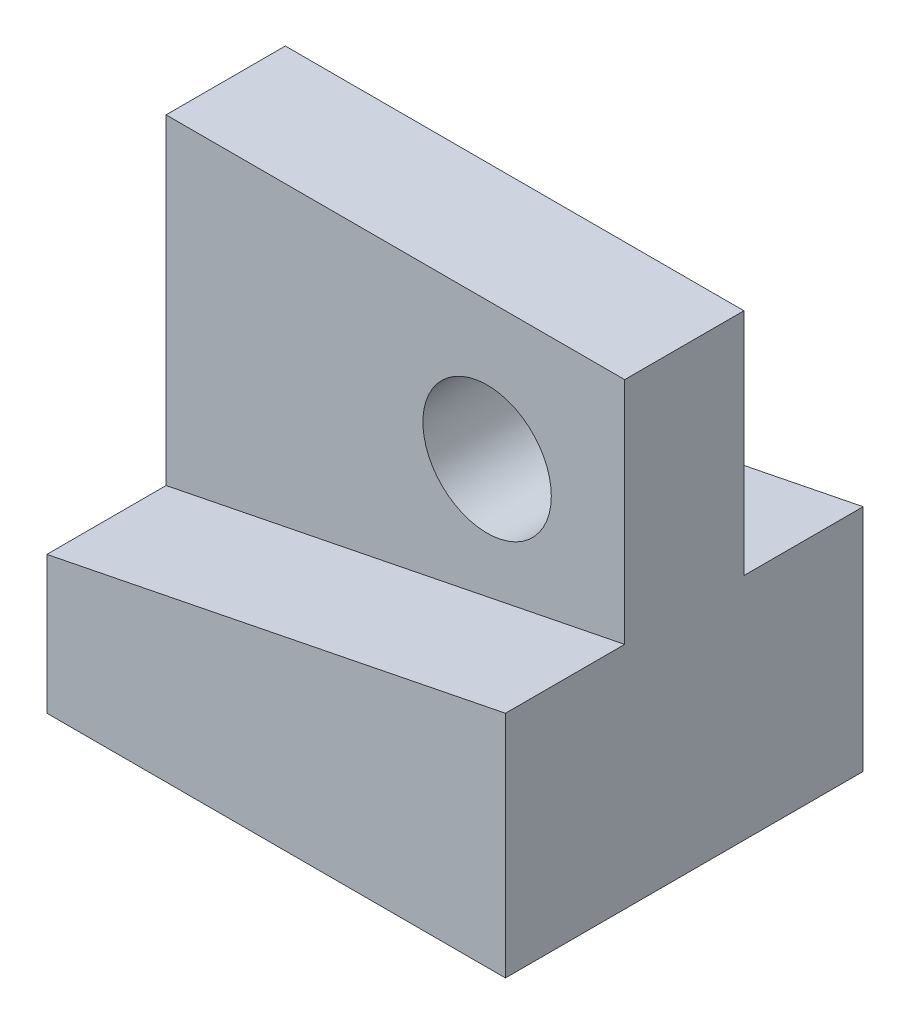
SolidWorks part; units mm, degrees
ref_plane "前视基准面" through (0, 0, 0) normal (0, 0, 1) x (1, 0, 0)
ref_plane "上视基准面" through (0, 0, 0) normal (0, 1, 0) x (1, 0, 0)
ref_plane "右视基准面" through (0, 0, 0) normal (1, 0, 0) x (0, 0, -1)
sketch "草图1" plane through (0, 0, 0) normal (0, 0, 1) x (1, 0, 0)
  line L0 (0, 0) -> (0, 70.4646) construction
  line L1 (0, 70.4646) -> (0, 0) construction
  line L2 (0, 0) -> (64.782, 0) construction
  line L4 (-25, 25) -> (25, 25)
  line L5 (-25, 25) -> (-25, -25)
  line L6 (-25, -25) -> (25, -25)
  line L7 (25, 25) -> (25, -25)
extrude "拉伸1" add sketch "草图1" along normal mid plane 39
sketch "草图2" plane through (0, 0, 19.5) normal (0, 0, 1) x (1, 0, 0)
  line L0 (25, 25) -> (-25, 25)
  line L1 (-25, 25) -> (-25, -10)
  line L2 (-25, 25) -> (-25, -25) construction
  line L3 (-25, -10) -> (25, 0)
  line L4 (25, -25) -> (25, 25) construction
  line L5 (25, 0) -> (25, 25)
extrude "切除-拉伸1" cut sketch "草图2" against normal blind 13
mirror "镜向1" about plane through (0, 0, 0) normal (0, 0, 1) of "切除-拉伸1"
sketch "草图3" plane through (0, 0, 6.5) normal (0, 0, 1) x (1, 0, 0)
  line L0 (25, 0) -> (25, 25) construction
  line L1 (25, 25) -> (-25, 25) construction
  circle A0 centre (10, 10) radius 7
  dimension "D1" = 15
  dimension "D2" = 15
extrude "切除-拉伸2" cut sketch "草图3" against normal blind 13
